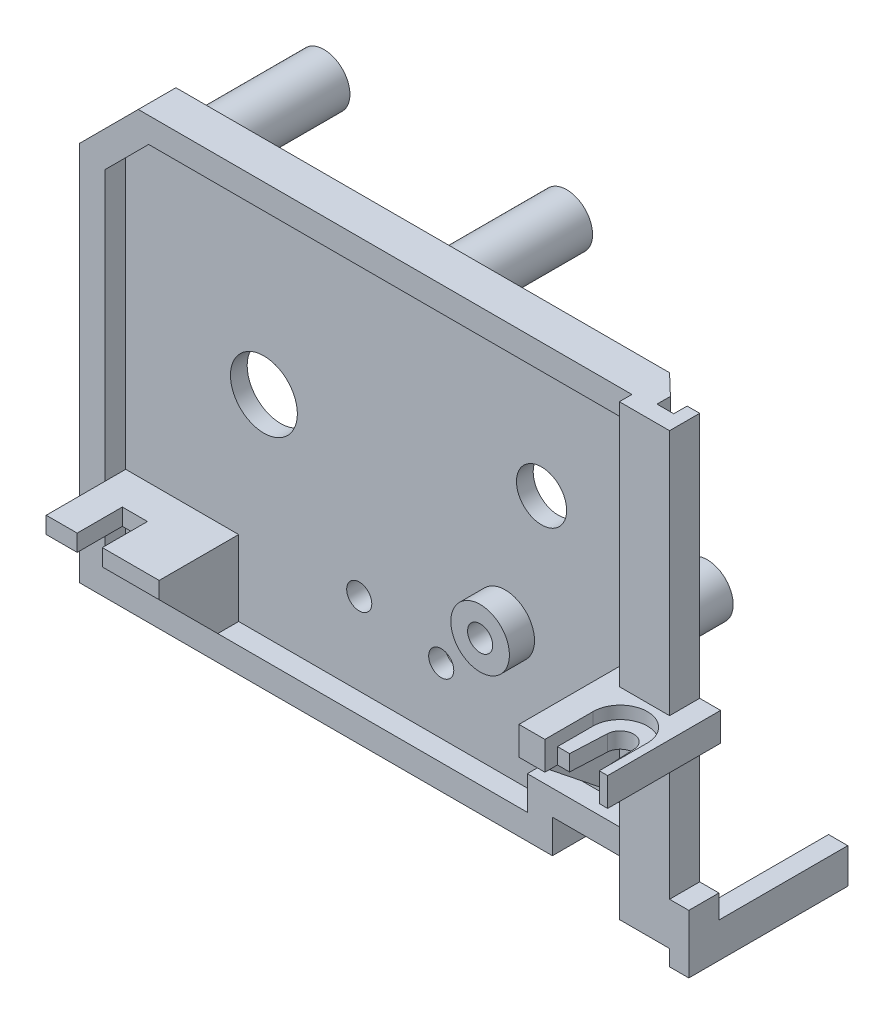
SolidWorks part; units mm, degrees
ref_plane "Plan de face" through (0, 0, 0) normal (0, 0, 1) x (1, 0, 0)
ref_plane "Plan de dessus" through (0, 0, 0) normal (0, 1, 0) x (1, 0, 0)
ref_plane "Plan de droite" through (0, 0, 0) normal (1, 0, 0) x (0, 0, -1)
sketch "Esquisse1" plane through (0, 0, 0) normal (0, 0, 1) x (1, 0, 0)
  line L0 (-31.8236, -16.2265) -> (-31.8236, 29.2735)
  line L1 (-31.8236, 29.2735) -> (-24.8236, 36.2735)
  line L2 (-24.8236, 36.2735) -> (34.1764, 36.2735)
  line L3 (34.1764, 36.2735) -> (34.1764, -12.2265)
  line L4 (34.1764, -12.2265) -> (24.6764, -12.2265)
  line L5 (24.6764, -12.2265) -> (24.6764, -16.2265)
  line L6 (-31.8236, -16.2265) -> (24.6764, -16.2265)
  dimension "D1" = 52.5
  dimension "D2" = 7
  dimension "D3" = 7
  dimension "D4" = 66
  dimension "D5" = 9.5
  dimension "D6" = 4
extrude "Extrusion1" add sketch "Esquisse1" along normal blind 4.5
sketch "Esquisse4" plane through (0, 0, 4.5) normal (0, 0, 1) x (1, 0, 0)
  line L0 (34.1764, 33.2735) -> (-23.5809, 33.2735)
  line L1 (-23.5809, 33.2735) -> (-28.8236, 28.0308)
  line L2 (-28.8236, 28.0308) -> (-28.8236, -13.2265)
  line L3 (-28.8236, -13.2265) -> (21.6764, -13.2265)
  line L4 (21.6764, -13.2265) -> (21.6764, -9.2265)
  line L5 (21.6764, -9.2265) -> (34.1764, -9.2265)
  line L7 (34.1764, -9.2265) -> (34.1764, 33.2735)
  line L8 (34.1764, 36.2735) -> (-24.8236, 36.2735) construction
  line L9 (-24.8236, 36.2735) -> (-31.8236, 29.2735) construction
  line L10 (-31.8236, 29.2735) -> (-31.8236, -16.2265) construction
  line L11 (-31.8236, -16.2265) -> (24.6764, -16.2265) construction
  line L12 (24.6764, -16.2265) -> (24.6764, -12.2265) construction
  line L13 (24.6764, -12.2265) -> (34.1764, -12.2265) construction
  line L14 (34.1764, -12.2265) -> (34.1764, 36.2735) construction
  point P19 (29.4264, -12.2265)
  dimension "D1" = 3
  dimension "D2" = 3
  dimension "D3" = 3
  dimension "D4" = 3
  dimension "D5" = 3
  dimension "D6" = 3
extrude "Enlèv. mat.-Extru.1" cut sketch "Esquisse4" against normal blind 2.5
sketch "Esquisse5" plane through (0, 36.2735, 0) normal (0, 1, 0) x (-1, 0, 0)
  line L0 (-34.1764, 0) -> (-34.1764, 6)
  line L1 (-34.1764, 6) -> (-40.1764, 6)
  line L2 (-40.1764, 6) -> (-40.1764, 2.4)
  line L3 (-40.1764, 2.4) -> (-38.6764, 2.4)
  line L4 (-38.6764, 2.4) -> (-38.6764, 4)
  line L5 (-38.6764, 4) -> (-36.6764, 4)
  line L6 (-36.6764, 4) -> (-36.6764, 2.4)
  line L7 (-36.6764, 2.4) -> (-34.1764, 0)
  line L8 (-34.1764, 0) -> (24.8236, 0) construction
  dimension "D1" = 6
  dimension "D2" = 2
  dimension "D3" = 1.5
  dimension "D4" = 2
  dimension "D5" = 3.6
  dimension "D6" = 6
extrude "Extrusion2" add sketch "Esquisse5" against normal blind 53.6
sketch "Esquisse6" plane through (-31.8236, 0, 0) normal (-1, 0, 0) x (0, 0, 1)
  line L0 (4.5, -16.2265) -> (0, -16.2265) construction
  line L1 (-12.9, 1.7735) -> (2.1, 1.7735)
  line L2 (-12.9, 1.7735) -> (-12.9, -7.2265)
  line L3 (-12.9, -7.2265) -> (2.1, -7.2265)
  line L4 (2.1, 1.7735) -> (2.1, -7.2265)
  line L5 (4.5, 29.2735) -> (4.5, -16.2265) construction
  dimension "D1" = 9
  dimension "D2" = 9
  dimension "D3" = 15
  dimension "D4" = 2.4
extrude "Extrusion3" add sketch "Esquisse6" along normal blind 2
sketch "Esquisse7" plane through (0, 0, 2) normal (0, 0, 1) x (1, 0, 0)
  line L0 (-28.8236, 28.0308) -> (-28.8236, -13.2265) construction
  line L1 (-28.8236, -4.2265) -> (-15.3236, -4.2265)
  line L2 (-28.8236, -4.2265) -> (-28.8236, -6.2265)
  line L3 (-28.8236, -6.2265) -> (-15.3236, -6.2265)
  line L4 (-15.3236, -4.2265) -> (-15.3236, -6.2265)
  line L5 (-31.8236, -16.2265) -> (24.6764, -16.2265) construction
  dimension "D1" = 2
  dimension "D2" = 13.5
  dimension "D3" = 10
extrude "Extrusion4" add sketch "Esquisse7" along normal blind 9.5
sketch "Esquisse8" plane through (-15.3236, 0, 0) normal (1, 0, 0) x (0, 0, -1)
  line L0 (-11.5, -6.2265) -> (-4.5, -13.2265)
rib "Nervure1" sketch "Esquisse8" sketch "Esquisse8" thickness 2 extrusion direction parallel to sketch draft on no parameters "D1"=2
sketch "Esquisse9" plane through (0, -6.2265, 0) normal (0, -1, 0) x (1, 0, 0)
  line L0 (-28.8236, 11.5) -> (-17.3236, 11.5) construction
  line L1 (-25.1236, 11.5) -> (-22.1236, 11.5)
  line L2 (-25.1236, 11.5) -> (-25.1236, 6.1)
  line L3 (-25.1236, 6.1) -> (-22.1236, 6.1)
  line L4 (-22.1236, 11.5) -> (-22.1236, 6.1)
  line L5 (-28.8236, 11.5) -> (-28.8236, 4.5) construction
  dimension "D1" = 5.4
  dimension "D2" = 3
  dimension "D3" = 3.7
extrude "Enlèv. mat.-Extru.2" cut sketch "Esquisse9" against normal through all
sketch "Esquisse10" plane through (40.1764, 0, 0) normal (1, 0, 0) x (0, 0, -1)
  line L0 (-6, -12.2265) -> (-6, -19.2265)
  line L1 (-6, -17.3265) -> (-6, 36.2735) construction
  line L2 (-6, -19.2265) -> (13, -19.2265)
  line L3 (13, -19.2265) -> (13, -15.0265)
  line L4 (13, -15.0265) -> (-2.4, -15.0265)
  line L5 (-2.4, -17.3265) -> (-2.4, 36.2735) construction
  line L6 (-2.4, -15.0265) -> (-2.4, -12.2265)
  line L7 (-2.4, -12.2265) -> (-6, -12.2265)
  line L8 (-6, -17.3265) -> (-2.4, -17.3265) construction
  dimension "D1" = 19
  dimension "D2" = 4.2
  dimension "D3" = 1.9
  dimension "D4" = 7
extrude "Extrusion5" add sketch "Esquisse10" along normal blind 2.3
sketch "Esquisse11" plane through (0, 0, 6) normal (0, 0, 1) x (1, 0, 0)
  line L0 (-31.8236, -16.2265) -> (24.6764, -16.2265) construction
  line L1 (32.0764, 6.7735) -> (42.6764, 6.7735)
  line L2 (32.0764, 6.7735) -> (32.0764, 3.3735)
  line L3 (32.0764, 3.3735) -> (42.6764, 3.3735)
  line L4 (42.6764, 6.7735) -> (42.6764, 3.3735)
  line L5 (40.1764, -12.2265) -> (40.1764, 36.2735) construction
  dimension "D1" = 23
  dimension "D2" = 2.5
  dimension "D3" = 3.4
  dimension "D4" = 10.6
extrude "Extrusion6" add sketch "Esquisse11" along normal blind 9.9
sketch "Esquisse12" plane through (0, 0, 6) normal (0, 0, -1) x (-1, 0, 0)
  line L0 (-42.6764, 3.3735) -> (-42.6764, 6.7735) construction
  line L1 (-42.6764, 3.3735) -> (-42.6764, 6.7735)
  line L2 (-42.6764, 6.7735) -> (-40.1764, 6.7735) construction
  line L3 (-42.6764, 6.7735) -> (-40.1764, 6.7735)
  line L4 (-40.1764, 3.3735) -> (-42.6764, 3.3735) construction
  line L5 (-40.1764, 3.3735) -> (-42.6764, 3.3735)
  line L6 (-40.1764, 6.7735) -> (-40.1764, 3.3735)
extrude "Extrusion7" add sketch "Esquisse12" along normal up to surface (3.6 mm away)
sketch "Esquisse14" plane through (0, 0, 6) normal (0, 0, -1) x (-1, 0, 0)
  line L4 (-34.1764, 6.7735) -> (-34.1764, 3.3735)
  line L5 (-34.1764, 3.3735) -> (-32.0764, 3.3735)
  line L6 (-32.0764, 3.3735) -> (-32.0764, 6.7735)
  line L7 (-32.0764, 6.7735) -> (-34.1764, 6.7735)
  line L8 (-34.1764, 6.7735) -> (-34.1764, 3.3735)
  line L9 (-34.1764, 3.3735) -> (-32.0764, 3.3735)
  line L10 (-32.0764, 3.3735) -> (-32.0764, 6.7735)
  line L11 (-32.0764, 6.7735) -> (-34.1764, 6.7735)
  dimension "D1" = 0
extrude "Extrusion8" add sketch "Esquisse14" along normal up to next
sketch "Esquisse15" plane through (0, 6.7735, 0) normal (0, 1, 0) x (-1, 0, 0)
  line L0 (-35.1764, 15.9) -> (-41.6764, 15.9)
  line L1 (-42.6764, 15.9) -> (-32.0764, 15.9) construction
  line L2 (-41.6764, 15.9) -> (-41.6764, 10.15)
  line L3 (-42.6764, 15.9) -> (-42.6764, 2.4) construction
  line L5 (-35.1764, 15.9) -> (-35.1764, 10.15)
  arc A0 (-35.1764, 10.15) -> (-41.6764, 10.15) centre (-38.4264, 10.15) cw
  dimension "D1" = 1
  dimension "D2" = 6.5
  dimension "D3" = 5.75
extrude "Enlèv. mat.-Extru.3" cut sketch "Esquisse15" against normal blind 1.5
sketch "Esquisse16" plane through (0, 5.2735, 0) normal (0, 1, 0) x (-1, 0, 0)
  line L0 (-35.1764, 14.4) -> (-36.6264, 14.4)
  line L1 (-36.6264, 14.4) -> (-36.8282, 10.0754)
  line L2 (-41.6764, 14.4) -> (-40.2264, 14.4)
  line L3 (-35.1764, 10.15) -> (-35.1764, 15.9)
  line L4 (-35.1764, 15.9) -> (-41.6764, 15.9)
  line L5 (-41.6764, 15.9) -> (-41.6764, 10.15)
  line L6 (-35.1764, 10.15) -> (-35.1764, 15.9)
  line L7 (-35.1764, 15.9) -> (-41.6764, 15.9)
  line L8 (-41.6764, 15.9) -> (-41.6764, 10.15)
  line L9 (-40.2264, 14.4) -> (-40.0247, 10.0754)
  arc A0 (-40.0247, 10.0754) -> (-36.8282, 10.0754) centre (-38.4264, 10.15) ccw
  arc A1 (-41.6764, 10.15) -> (-35.1764, 10.15) centre (-38.4264, 10.15) ccw
  arc A2 (-41.6764, 10.15) -> (-35.1764, 10.15) centre (-38.4264, 10.15) ccw
  dimension "D2" = 3.2
  dimension "D4" = 1.8
  dimension "D3" = 3.6
  dimension "D5" = 1.5
  dimension "D1" = 0
extrude "Enlèv. mat.-Extru.4" cut sketch "Esquisse16" against normal through all contours L9 A0 L1 L0 L2 M5 M6 M7
sketch "Esquisse17" plane through (32.0764, 0, 0) normal (-1, 0, 0) x (0, 0, 1)
  line L0 (2, -9.2265) -> (2, 3.3735) construction
  line L1 (2, -9.2265) -> (2, 3.3735) construction
  line L2 (15.9, 3.3735) -> (2, -7.7265)
  dimension "D1" = 1.5
rib "Nervure2" sketch "Esquisse17" sketch "Esquisse17" thickness 1 extrusion direction parallel to sketch draft on no parameters "D1"=1
sketch "Esquisse18" plane through (0, 0, 0) normal (0, 0, -1) x (-1, 0, 0)
  line L0 (31.8236, 29.2735) -> (31.8236, 1.7735) construction
  line L1 (-34.1764, 36.2735) -> (24.8236, 36.2735) construction
  line L2 (31.8236, -16.2265) -> (-24.6764, -16.2265) construction
  line L3 (31.8236, -7.2265) -> (31.8236, -16.2265) construction
  circle A0 centre (21.8236, 31.2735) radius 3.1
  circle A1 centre (-7.1764, 31.2735) radius 3.1
  circle A2 centre (-23.9764, 1.3735) radius 3.1
  circle A3 centre (20.5236, -10.2265) radius 3.1
  dimension "D1" = 6.2
  dimension "D2" = 10
  dimension "D3" = 5
  dimension "D4" = 29
  dimension "D5" = 6
  dimension "D6" = 11.3
  dimension "D7" = 11.6
  dimension "D8" = 44.5
extrude "Extrusion9" add sketch "Esquisse18" along normal blind 14.7
hole_wizard "Trou taraudé M31" positions "Esquisse3D1" profile "Esquisse19" tap size "M3" standard "ISO"
sketch3d "Esquisse3D1"
  line L0 (7.1764, 31.2735, -14.7) -> (7.1764, 31.2735, 0) construction
  line L1 (-21.8236, 31.2735, -14.7) -> (-21.8236, 31.2735, 0) construction
  line L2 (23.9764, 1.3735, -14.7) -> (23.9764, 1.3735, 0) construction
  line L3 (-20.5236, -10.2265, -14.7) -> (-20.5236, -10.2265, 0) construction
  point P0 (7.1764, 31.2735, -14.7)
  point P4 (-21.8236, 31.2735, -14.7)
  point P8 (23.9764, 1.3735, -14.7)
  point P12 (-20.5236, -10.2265, -14.7)
sketch "Esquisse19" plane through (7.1764, 31.2735, -14.7) normal (1, 0, 0) x (0, 1, 0)
  line L0 (0, 0) -> (0, 8.2511)
  line L1 (0, 8.2511) -> (1.25, 7.5)
  line L2 (1.25, 7.5) -> (1.25, 0)
  line L5 (1.25, 0) -> (0, 0)
  line L10 (0, 8.2511) -> (-1.25, 7.5) construction
  line L11 (0, -6.35) -> (0, 107.95) construction
  dimension "Diamètre du trou pour taraudage" = 2.5
  dimension "Profondeur du trou pour taraudage" = 7.5
  dimension "Angle de pointe" = 118
sketch "Esquisse20" plane through (0, 0, 2) normal (0, 0, 1) x (1, 0, 0)
  line L0 (34.1764, 36.2735) -> (40.1764, 36.2735) construction
  line L1 (40.1764, 6.7735) -> (40.1764, 36.2735) construction
  circle A0 centre (20.8764, 17.8735) radius 3
  dimension "D1" = 6
  dimension "D3" = 19.3
  dimension "D2" = 18.4
extrude "Perçage pignon moteur" cut sketch "Esquisse20" against normal through all
sketch "Esquisse21" plane through (0, 0, 2) normal (0, 0, 1) x (1, 0, 0)
  line L0 (20.8764, 17.8735) -> (16.5361, 2.4734) construction
  line L1 (34.1764, 6.7735) -> (34.1764, 36.2735) construction
  circle A0 centre (16.5361, 2.4734) radius 3.5
  circle A1 centre (20.8764, 17.8735) radius 16 construction
  dimension "D1" = 7
  dimension "D2" = 32
  dimension "D3" = 15.74
extrude "Extrusion10" add sketch "Esquisse21" along normal blind 3
sketch "Esquisse22" plane through (0, 0, 5) normal (0, 0, 1) x (1, 0, 0)
  circle A0 centre (16.5361, 2.4734) radius 1.5
  dimension "D1" = 3
extrude "Enlèv. mat.-Extru.6" cut sketch "Esquisse22" against normal through all
sketch "Esquisse23" plane through (0, 0, 2) normal (0, 0, 1) x (1, 0, 0)
  circle A0 centre (16.5361, 2.4734) radius 11 construction
  circle A1 centre (8.8861, -5.4309) radius 1.5
  dimension "D1" = 22
  dimension "D2" = 3
  dimension "D3" = 7.65
extrude "Perçage roue intermediaire 2" cut sketch "Esquisse23" against normal through all
sketch "Esquisse24" plane through (0, 0, 2) normal (0, 0, 1) x (1, 0, 0)
  circle A0 centre (8.8861, -5.4309) radius 10 construction
  circle A1 centre (-0.9119, -3.4309) radius 1.5
  dimension "D1" = 20
  dimension "D2" = 3
  dimension "D3" = 2
extrude "Perçage roue intermediaire 2_1" cut sketch "Esquisse24" against normal through all
sketch "Esquisse25" plane through (0, 0, 2) normal (0, 0, 1) x (1, 0, 0)
  line L0 (-12.3066, 11.7731) -> (-0.9119, -3.4309) construction
  line L1 (-15.3236, -13.2265) -> (21.6764, -13.2265) construction
  circle A0 centre (-0.9119, -3.4309) radius 19 construction
  circle A1 centre (-12.3066, 11.7731) radius 4
  dimension "D1" = 38
  dimension "D3" = 8
  dimension "D2" = 53.15
extrude "Perçage roue excentrique" cut sketch "Esquisse25" against normal through all
sketch "Esquisse26" plane through (0, 0, 0) normal (0, 0, -1) x (-1, 0, 0)
  circle A0 centre (0.9119, -3.4309) radius 2.25
  circle A1 centre (0.9119, -3.4309) radius 1.5 construction
  circle A2 centre (0.9119, -3.4309) radius 1.5
  dimension "D1" = 4.5
extrude "Extrusion11" add sketch "Esquisse26" along normal blind 3
equation "\"D3@Esquisse1\" = \"D2@Esquisse1\""
equation "\"D2@Esquisse4\" = \"D1@Esquisse4\""
equation "\"D3@Esquisse4\" = \"D1@Esquisse4\""
equation "\"D4@Esquisse4\" = \"D1@Esquisse4\""
equation "\"D5@Esquisse4\" = \"D1@Esquisse4\""
equation "\"D6@Esquisse4\" = \"D1@Esquisse4\""
equation "\"D4@Esquisse16\" = \"D3@Esquisse16\" / 2"
